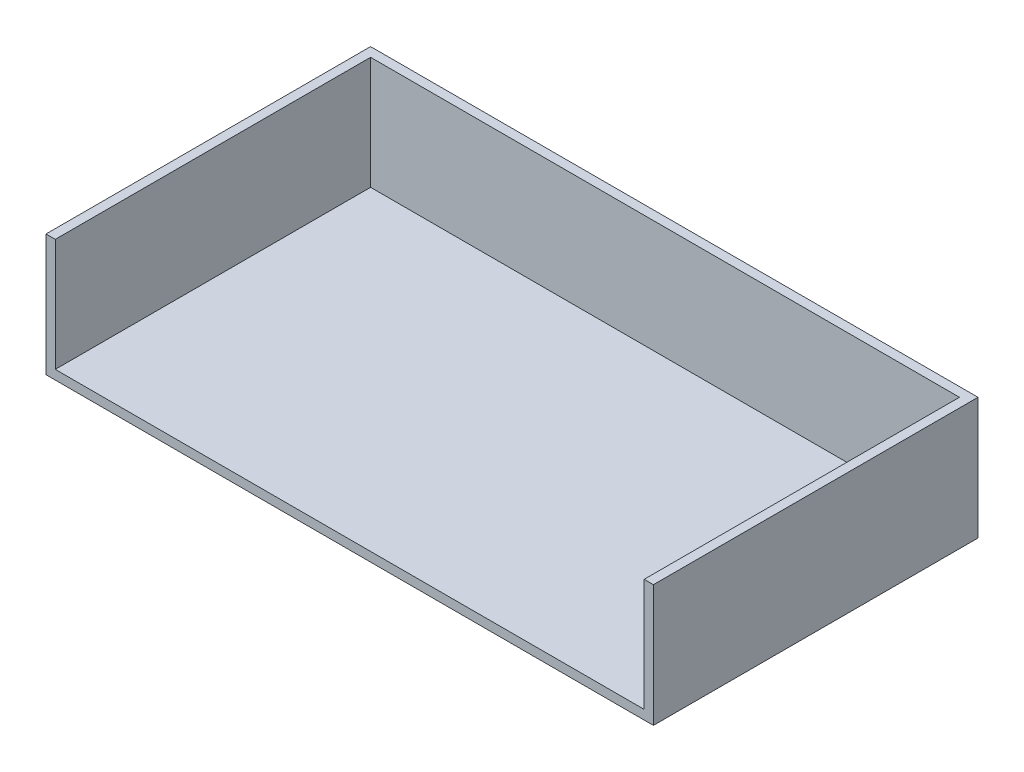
SolidWorks part; units mm, degrees
ref_plane "Front Plane" through (0, 0, 0) normal (0, 0, 1) x (1, 0, 0)
ref_plane "Top Plane" through (0, 0, 0) normal (0, 1, 0) x (1, 0, 0)
ref_plane "Right Plane" through (0, 0, 0) normal (1, 0, 0) x (0, 0, -1)
sketch "Sketch1" plane through (0, 0, 0) normal (0, 0, 1) x (1, 0, 0)
  line L1 (0, 0) -> (131, 0)
  line L2 (0, 0) -> (0, 26.29)
  line L3 (0, 26.29) -> (131, 26.29)
  line L4 (131, 0) -> (131, 26.29)
  dimension "D1" = 131
  dimension "D2" = 26.29
extrude "Boss-Extrude1" add sketch "Sketch1" along normal blind 70
sketch "Sketch2" plane through (0, 26.29, 0) normal (0, 1, 0) x (1, 0, 0)
  line L1 (2, -2) -> (129, -2)
  line L2 (2, -2) -> (2, -70)
  line L3 (2, -70) -> (129, -70)
  line L4 (129, -2) -> (129, -70)
  line L6 (0, -70) -> (0, 0) construction
  line L7 (131, -70) -> (131, 0) construction
  line L8 (131, 0) -> (0, 0) construction
  line L9 (131, -70) -> (0, -70) construction
  dimension "D1" = 2
  dimension "D2" = 2
  dimension "D3" = 2
extrude "Cut-Extrude1" cut sketch "Sketch2" against normal blind 24.29
